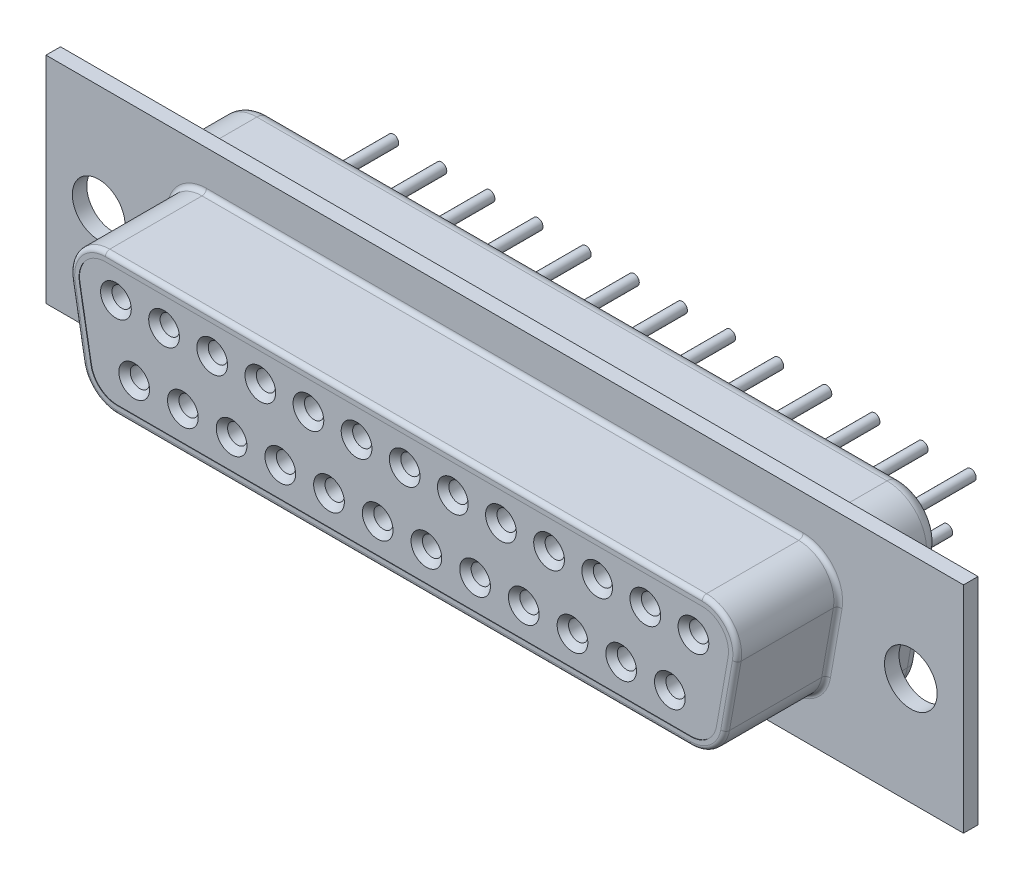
SolidWorks part; units mm, degrees
ref_plane "Front Plane" through (0, 0, 0) normal (0, 0, 1) x (1, 0, 0)
ref_plane "Top Plane" through (0, 0, 0) normal (0, 1, 0) x (1, 0, 0)
ref_plane "Right Plane" through (0, 0, 0) normal (1, 0, 0) x (0, 0, -1)
sketch "Sketch1" plane through (0, 0, 0) normal (0, 0, 1) x (1, 0, 0)
  line L0 (26.543, 6.223) -> (-26.543, -6.223) construction
  line L1 (-26.543, 6.223) -> (26.543, 6.223)
  line L2 (-26.543, 6.223) -> (-26.543, -6.223)
  line L3 (-26.543, -6.223) -> (26.543, -6.223)
  line L4 (26.543, 6.223) -> (26.543, -6.223)
  dimension "D1" = 53.086
  dimension "D2" = 12.446
extrude "Extrude1" add sketch "Sketch1" along normal mid plane 0.8382
sketch "Sketch2" plane through (0, 0, 0.4191) normal (0, 0, 1) x (1, 0, 0)
  line L0 (0, 0) -> (0, 21.2946) construction
  line L1 (0, 0) -> (32.2827, 0) construction
  line L2 (19.685, 3.937) -> (-19.685, -3.937) construction
  line L3 (17.2634, 3.937) -> (-17.2634, 3.937)
  line L4 (-19.2645, 1.5521) -> (-18.5927, -2.2579)
  line L5 (16.5916, -3.937) -> (-16.5916, -3.937)
  line L7 (19.2645, 1.5521) -> (18.5927, -2.2579)
  arc A0 (-17.2634, 3.937) -> (-19.2645, 1.5521) centre (-17.2634, 1.905) ccw
  arc A1 (-18.5927, -2.2579) -> (-16.5916, -3.937) centre (-16.5916, -1.905) ccw
  arc A2 (18.5927, -2.2579) -> (16.5916, -3.937) centre (16.5916, -1.905) cw
  arc A3 (17.2634, 3.937) -> (19.2645, 1.5521) centre (17.2634, 1.905) cw
  point P11 (-19.685, 3.937)
  point P14 (-18.2966, -3.937)
  point P17 (18.2966, -3.937)
  dimension "D1" = 2.032
  dimension "D2" = 39.37
extrude "Extrude2" add sketch "Sketch2" along normal blind 5.842
sketch "Sketch3" plane through (0, 0, 6.2611) normal (0, 0, 1) x (1, 0, 0)
  line L8 (-18.7642, 1.6404) -> (-18.0924, -2.1696)
  line L9 (-16.5916, -3.429) -> (16.5916, -3.429)
  line L10 (18.0924, -2.1696) -> (18.7642, 1.6404)
  line L11 (17.2634, 3.429) -> (-17.2634, 3.429)
  line L12 (-18.7642, 1.6404) -> (-18.0924, -2.1696)
  line L13 (-16.5916, -3.429) -> (16.5916, -3.429)
  line L14 (18.0924, -2.1696) -> (18.7642, 1.6404)
  line L15 (17.2634, 3.429) -> (-17.2634, 3.429)
  arc A8 (-17.2634, 3.429) -> (-18.7642, 1.6404) centre (-17.2634, 1.905) ccw
  arc A9 (-18.0924, -2.1696) -> (-16.5916, -3.429) centre (-16.5916, -1.905) ccw
  arc A10 (16.5916, -3.429) -> (18.0924, -2.1696) centre (16.5916, -1.905) ccw
  arc A11 (18.7642, 1.6404) -> (17.2634, 3.429) centre (17.2634, 1.905) ccw
  arc A12 (-17.2634, 3.429) -> (-18.7642, 1.6404) centre (-17.2634, 1.905) ccw
  arc A13 (-18.0924, -2.1696) -> (-16.5916, -3.429) centre (-16.5916, -1.905) ccw
  arc A14 (16.5916, -3.429) -> (18.0924, -2.1696) centre (16.5916, -1.905) ccw
  arc A15 (18.7642, 1.6404) -> (17.2634, 3.429) centre (17.2634, 1.905) ccw
  dimension "D1" = 0.508
extrude "Cut-Extrude1" cut sketch "Sketch3" against normal blind 0.0254
fillet "Fillet1" radius 0.254 16 edges at (-17.8977, -3.4616, 6.2611) (-18.9286, -0.3529, 6.2611) (-18.82, 3.2111, 6.2611) (0, 3.937, 6.2611) (18.82, 3.2111, 6.2611) (18.9286, -0.3529, 6.2611) (17.8977, -3.4616, 6.2611) (-17.8977, -3.4616, 0.4191) (-18.9286, -0.3529, 0.4191) (-18.82, 3.2111, 0.4191) (0, 3.937, 0.4191) (18.82, 3.2111, 0.4191) (18.9286, -0.3529, 0.4191) (17.8977, -3.4616, 0.4191) (0, -3.937, 6.2611) (0, -3.937, 0.4191)
sketch "Sketch4" plane through (0, 0, 6.2357) normal (0, 0, 1) x (1, 0, 0)
  point P0 (16.7342, 1.7208)
  point P1 (15.3705, -1.729)
  point P2 (12.5529, -1.729)
  point P4 (13.9496, 1.7254)
  point P5 (11.1651, 1.73)
  point P6 (8.3806, 1.7346)
  point P7 (5.596, 1.7391)
  point P8 (2.8115, 1.7437)
  point P9 (0.0269, 1.7483)
  point P10 (-2.7576, 1.7528)
  point P11 (-5.5422, 1.7574)
  point P12 (-8.3267, 1.762)
  point P13 (-11.1113, 1.7666)
  point P14 (-13.8958, 1.7711)
  point P15 (-16.6803, 1.7757)
  point P16 (9.7352, -1.729)
  point P17 (6.9176, -1.729)
  point P18 (4.0999, -1.729)
  point P19 (1.2822, -1.729)
  point P20 (-1.5354, -1.729)
  point P21 (-4.3531, -1.729)
  point P22 (-7.1707, -1.729)
  point P23 (-9.9884, -1.729)
  point P24 (-12.806, -1.729)
  point P25 (-15.6237, -1.729)
hole_wizard "CSK for #4 Flat Head Machine Screw (100)1" positions "Sketch6" profile "Sketch5" countersink size "#4" standard "Ansi Inch"
sketch "Sketch6" plane through (0, 0, 6.2357) normal (0, 0, 1) x (1, 0, 0)
  point P2 (16.7342, 1.7208)
  point P5 (13.9496, 1.7254)
  point P8 (11.1651, 1.73)
  point P11 (8.3806, 1.7346)
  point P14 (5.596, 1.7391)
  point P17 (2.8115, 1.7437)
  point P20 (0.0269, 1.7483)
  point P23 (-2.7576, 1.7528)
  point P26 (-5.5422, 1.7574)
  point P29 (-8.3267, 1.762)
  point P32 (-11.1113, 1.7666)
  point P35 (-13.8958, 1.7711)
  point P38 (-16.6803, 1.7757)
  point P41 (-15.6237, -1.729)
  point P44 (-12.806, -1.729)
  point P47 (-9.9884, -1.729)
  point P50 (-7.1707, -1.729)
  point P53 (-4.3531, -1.729)
  point P56 (-1.5354, -1.729)
  point P59 (1.2822, -1.729)
  point P62 (4.0999, -1.729)
  point P65 (6.9176, -1.729)
  point P68 (9.7352, -1.729)
  point P71 (12.5529, -1.729)
  point P74 (15.3705, -1.729)
sketch "Sketch5" plane through (16.7342, 1.7208, 6.2357) normal (1, 0, 0) x (0, -1, 0)
  line L0 (0, 0) -> (0, 6.1524)
  line L1 (0, 6.1524) -> (0.5588, 5.8166)
  line L2 (0.5588, 5.8166) -> (0.5588, 0.3302)
  line L3 (0.5588, 0.3302) -> (0.889, 0)
  line L5 (0.889, 0) -> (0, 0)
  line L6 (-0.5588, 0.3302) -> (-0.889, 0) construction
  line L10 (0, 6.1524) -> (-0.5588, 5.8166) construction
  line L11 (0, -6.35) -> (0, 107.95) construction
  dimension "Hole Dia." = 1.1176
  dimension "Hole Depth" = 5.8166
  dimension "Near C'Sink Dia." = 1.778
  dimension "Near C'Sink Angle" = 90
  dimension "Drill Angle" = 118
sketch "Sketch7" plane through (0, 0, -0.4191) normal (0, 0, -1) x (-1, 0, 0)
  line L0 (20.955, 5.334) -> (-20.955, -5.334) construction
  line L1 (-18.2307, 5.334) -> (18.2307, 5.334)
  line L3 (-17.1558, -5.334) -> (17.1558, -5.334)
  line L4 (0, 0) -> (0, 0.8803) construction
  line L5 (20.4819, 2.651) -> (19.407, -3.445)
  line L6 (0, 0) -> (0, -13.6518) construction
  line L7 (-20.4819, 2.651) -> (-19.407, -3.445)
  arc A0 (-18.2307, 5.334) -> (-20.4819, 2.651) centre (-18.2307, 3.048) ccw
  arc A1 (-19.407, -3.445) -> (-17.1558, -5.334) centre (-17.1558, -3.048) ccw
  arc A2 (19.407, -3.445) -> (17.1558, -5.334) centre (17.1558, -3.048) cw
  arc A3 (18.2307, 5.334) -> (20.4819, 2.651) centre (18.2307, 3.048) cw
  point P11 (-20.955, 5.334)
  point P14 (-19.0739, -5.334)
  point P17 (19.0739, -5.334)
  dimension "D2" = 2.286
  dimension "D1" = 10.668
extrude "Extrude3" add sketch "Sketch7" along normal blind 3.81
sketch "Sketch8" plane through (0, 0, -4.2291) normal (0, 0, -1) x (-1, 0, 0)
  line L12 (-18.3693, 1.6404) -> (-17.6975, -2.1696)
  line L13 (-16.1967, -3.429) -> (16.1967, -3.429)
  line L14 (17.6975, -2.1696) -> (18.3693, 1.6404)
  line L15 (16.8685, 3.429) -> (-16.8685, 3.429)
  arc A9 (-18.3693, 1.6404) -> (-16.8685, 3.429) centre (-16.8685, 1.905) cw
  arc A10 (-16.1967, -3.429) -> (-17.6975, -2.1696) centre (-16.1967, -1.905) cw
  arc A11 (16.1967, -3.429) -> (17.6975, -2.1696) centre (16.1967, -1.905) ccw
  arc A12 (16.8685, 3.429) -> (18.3693, 1.6404) centre (16.8685, 1.905) cw
  dimension "D1" = 1.524
extrude "Extrude4" add sketch "Sketch8" along normal blind 1.016
sketch "Sketch9" plane through (0, 0, -5.2451) normal (0, 0, -1) x (-1, 0, 0)
  circle A0 centre (16.6803, 1.7757) radius 0.3048
  point P2 (16.6803, 1.7757)
  point P3 (15.6237, -1.729)
  point P4 (12.806, -1.729)
  point P5 (13.8958, 1.7711)
  point P6 (11.1113, 1.7666)
  point P7 (9.9884, -1.729)
  point P8 (7.1707, -1.729)
  point P9 (8.3267, 1.762)
  point P10 (5.5422, 1.7574)
  point P11 (4.3531, -1.729)
  point P12 (1.5354, -1.729)
  point P13 (2.7576, 1.7528)
  point P14 (-0.0269, 1.7483)
  point P15 (-2.8115, 1.7437)
  point P16 (-5.596, 1.7391)
  point P17 (-8.3806, 1.7346)
  point P18 (-11.1651, 1.73)
  point P19 (-13.9496, 1.7254)
  point P20 (-16.7342, 1.7208)
  point P21 (-15.3705, -1.729)
  point P22 (-12.5529, -1.729)
  point P23 (-9.7352, -1.729)
  point P24 (-6.9176, -1.729)
  point P25 (-4.0999, -1.729)
  point P26 (-1.2822, -1.729)
  dimension "D1" = 0.6096
extrude "Extrude5" add sketch "Sketch9" along normal blind 4.572
pattern_sketch "Sketch-Pattern2" of "Extrude5"
fillet "Fillet2" radius 0.762 16 edges at (19.9445, -0.397, -4.2291) (19.9818, 4.5174, -4.2291) (0, 5.334, -4.2291) (-19.9818, 4.5174, -4.2291) (-19.9445, -0.397, -4.2291) (-18.6252, -4.7992, -4.2291) (0, -5.334, -4.2291) (19.9445, -0.397, -0.4191) (19.9818, 4.5174, -0.4191) (0, 5.334, -0.4191) (-19.9818, 4.5174, -0.4191) (-19.9445, -0.397, -0.4191) (-18.6252, -4.7992, -0.4191) (0, -5.334, -0.4191) (18.6252, -4.7992, -4.2291) (18.6252, -4.7992, -0.4191)
sketch "Sketch10" plane through (0, 0, 0) normal (0, 0, 1) x (1, 0, 0)
  line L0 (0, 0) -> (33.1938, 0) construction
  line L1 (0, 0) -> (0, 11.1561) construction
  circle A0 centre (23.495, 0) radius 1.524
  circle A1 centre (-23.495, 0) radius 1.524
  dimension "D1" = 3.048
  dimension "D2" = 46.99
extrude "Cut-Extrude4" cut sketch "Sketch10" against normal through all and the other way through all
